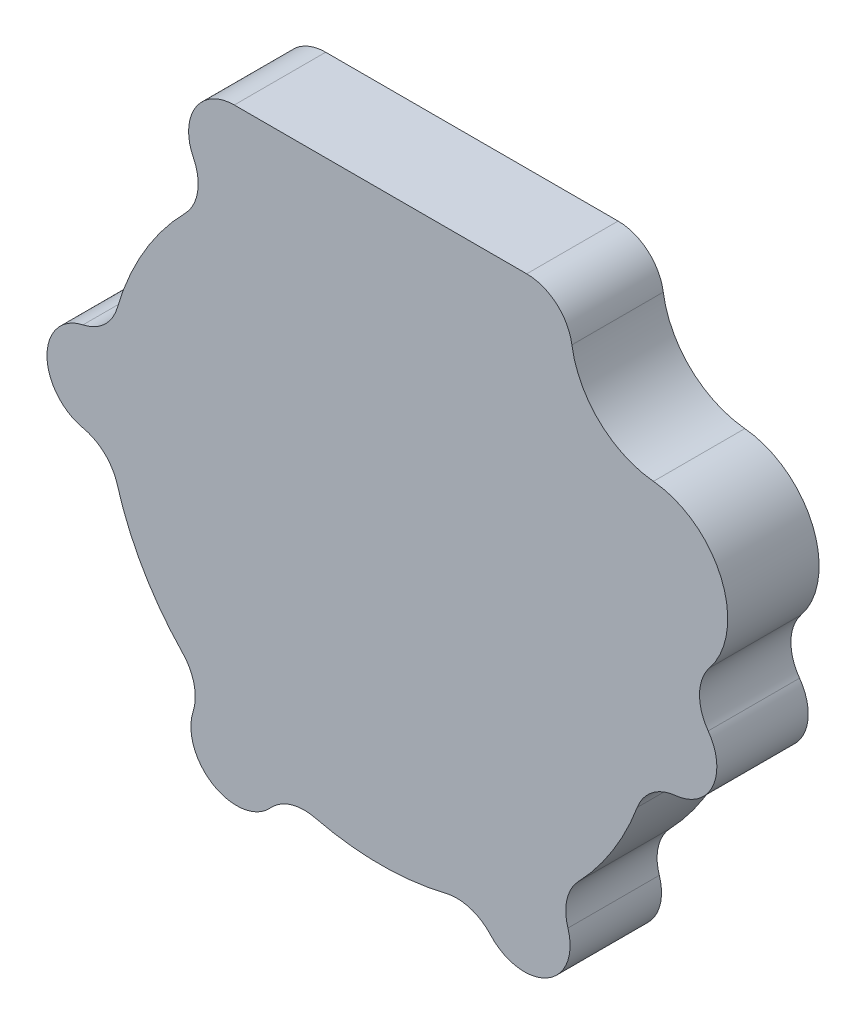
SolidWorks part; units mm, degrees
ref_plane "Plan de face" through (0, 0, 0) normal (0, 0, 1) x (1, 0, 0)
ref_plane "Plan de dessus" through (0, 0, 0) normal (0, 1, 0) x (1, 0, 0)
ref_plane "Plan de droite" through (0, 0, 0) normal (1, 0, 0) x (0, 0, -1)
sketch "Esquisse1" plane through (0, 0, 0) normal (0, 0, 1) x (1, 0, 0)
  line L5 (5.1731, 0) -> (-10.8269, 0)
  line L6 (5.1731, 0) -> (21.1731, 0)
  arc A0 (-27.3805, -29.1123) -> (-27.3805, -38.8877) centre (-26.3269, -34) ccw
  arc A1 (-15.3366, -59.7484) -> (-6.8708, -64.6361) centre (-10.5769, -61.2798) ccw
  arc A2 (17.2169, -64.6361) -> (25.6828, -59.7484) centre (20.9231, -61.2798) ccw
  arc A4 (-23.6331, -42.379) -> (-16.4864, -54.7573) centre (5.1731, -34) ccw
  arc A5 (-27.3805, -29.1123) -> (-23.6331, -25.621) centre (-28.4341, -24.2245) ccw
  arc A6 (-27.3805, -38.8877) -> (-23.6331, -42.379) centre (-28.4341, -43.7755) cw
  arc A7 (-15.3366, -59.7484) -> (-16.4864, -54.7573) centre (-20.0963, -58.2169) ccw
  arc A8 (-6.8708, -64.6361) -> (-1.9736, -63.1363) centre (-3.1647, -67.9924) cw
  arc A9 (17.2169, -64.6361) -> (12.3197, -63.1363) centre (13.5108, -67.9924) ccw
  arc A10 (25.6828, -59.7484) -> (26.8325, -54.7573) centre (30.4425, -58.2169) cw
  arc A11 (-1.9736, -63.1363) -> (12.3197, -63.1363) centre (5.1731, -34) ccw
  arc A12 (26.8325, -54.7573) -> (33.2684, -44.5191) centre (5.1731, -34) ccw
  arc A13 (-10.8269, 0) -> (-15.303, -7.2282) centre (-10.8269, -5) ccw
  arc A14 (-15.303, -7.2282) -> (-16.2145, -12.9626) centre (-19.7791, -9.4564) cw
  arc A15 (21.1731, 0) -> (26.1181, -4.2604) centre (21.1731, -5) cw
  arc A16 (26.1181, -4.2604) -> (35.0401, -12.7342) centre (36.0081, -2.7812) ccw
  arc A17 (35.0401, -12.7342) -> (41.1851, -27.3288) centre (34.169, -21.692) cw
  arc A18 (41.1851, -27.3288) -> (41.0312, -33.39) centre (45.083, -30.4603) ccw
  arc A19 (41.0312, -33.39) -> (37.4652, -41.296) centre (36.9794, -36.3196) cw
  arc A20 (37.4652, -41.296) -> (33.2684, -44.5191) centre (37.951, -46.2723) ccw
  arc A21 (-16.2145, -12.9626) -> (-23.6331, -25.621) centre (5.1731, -34) ccw
  dimension "D4" = 60
  dimension "D6" = 5
  dimension "D7" = 5
  dimension "D8" = 5
  dimension "D9" = 5
  dimension "D13" = 5
  dimension "D14" = 5
  dimension "D15" = 16
  dimension "D16" = 5
  dimension "D10" = 5
  dimension "D11" = 5
  dimension "D12" = 5
  dimension "D17" = 5
  dimension "D20" = 5
  dimension "D21" = 10
  dimension "D22" = 9
  dimension "D23" = 5
  dimension "D24" = 5
  dimension "D25" = 5
  dimension "D18" = 29
  dimension "D19" = 16
extrude "Boss.-Extru.1" add sketch "Esquisse1" along normal blind 10
